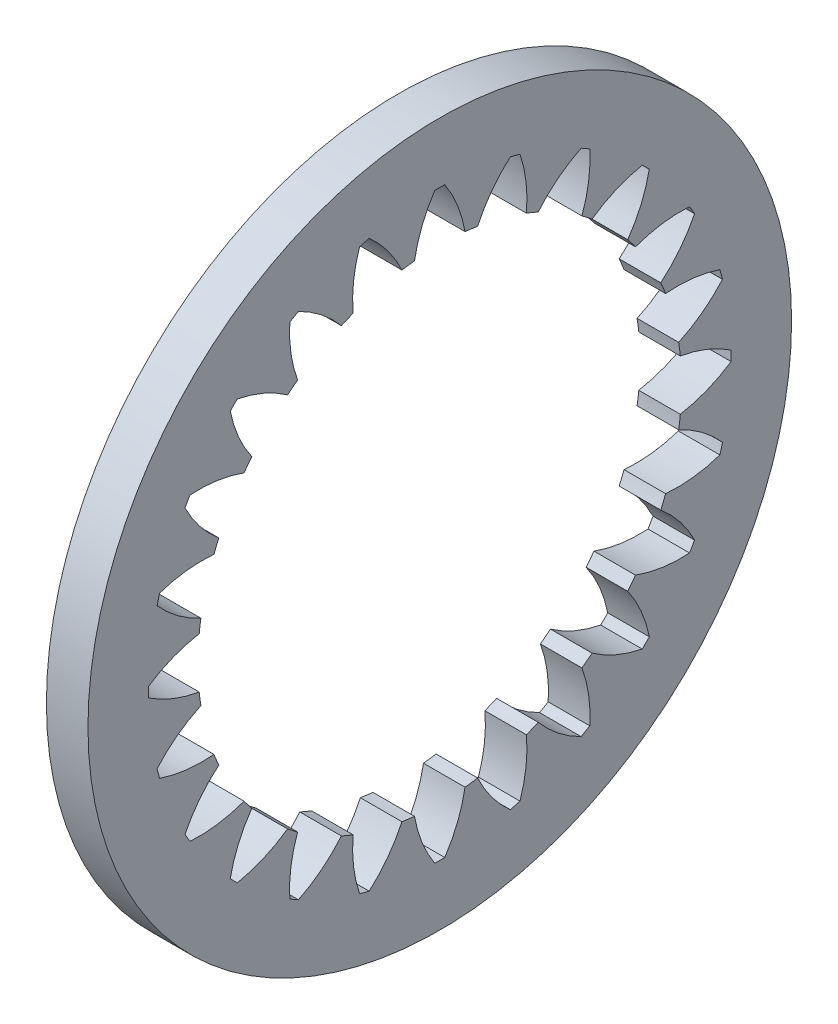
SolidWorks part; units mm, degrees
ref_plane "Plane1" through (0, 0, 0) normal (0, 0, 1) x (1, 0, 0)
ref_plane "Plane2" through (0, 0, 0) normal (0, 1, 0) x (1, 0, 0)
ref_plane "Plane3" through (0, 0, 0) normal (1, 0, 0) x (0, 0, -1)
other "Configuration Table"
sketch "HoldingSke" plane through (0, 0, 0) normal (0, 1, 0) x (1, 0, 0)
  line L0 (0, 0) -> (-0.0273, -0.1551)
  line L1 (-15, 0) -> (100, 0) construction
  line L2 (0, 0) -> (-2.1039, 2.3779)
  line L3 (0, 0) -> (-11.863, 4.5341)
  line L4 (0, 0) -> (7.8894, 3.5126)
  line L5 (0, 0) -> (-23.7986, -8.8762)
  line L6 (0, 0) -> (-10.5278, -7.1032)
  line L7 (-2.1039, 2.3779) -> (3.3635, 27.1825)
  line L8 (-76.2, 8.7279) -> (-54.61, 8.7279)
  line L9 (-67.7845, 28.3722) -> (-49.3413, 33.142)
  line L10 (-76.2, 71.12) -> (104.1128, 71.12)
  line L11 (0, 0) -> (-12, 0)
  line L12 (-76.2, 101.6) -> (-75.9714, 101.6)
  line L13 (24.9733, 27.94) -> (52.9518, 28.4284)
  line L14 (24.9733, 27.94) -> (24.9746, 27.94)
  line L15 (24.9733, 27.94) -> (100.4006, 29.5858)
  circle A0 centre (0, 0) radius 101.6
  circle A1 centre (0, 0) radius 12.7
  circle A2 centre (0, 0) radius 12.7
sketch "BasProSke" plane through (0, 0, 0) normal (0, 1, 0) x (1, 0, 0)
  line L0 (-10, 0) -> (60, 0) construction
  line L1 (0, 69.85) -> (0, 101.6)
  line L2 (0, 69.85) -> (12, 69.85)
  line L3 (12, 69.85) -> (12, 101.6)
  line L4 (12, 101.6) -> (0, 101.6)
revolve "Base-Revolve" add sketch "BasProSke" angle 360 about L0
sketch "TooCutSke" plane through (0, 0, 0) normal (1, 0, 0) x (0, 0, -1)
  line L3 (5.5552, 75.9972) -> (5.5552, 53.6633) construction
  line L4 (0, 0) -> (0, 59.563) construction
  line L5 (0, 0) -> (-8.9185, 67.7429) construction
  line L6 (-30.2541, 62.9855) -> (28.8527, 70.767) construction
  circle A0 centre (0, 0) radius 76.2 construction
  circle A1 centre (0, 0) radius 84.1388 construction
  circle A2 centre (0, 0) radius 66.3956 construction
  circle A3 centre (0, 0) radius 69.8246 construction
  arc A4 (7.2948, 69.4425) -> (1.4425, 84.1264) centre (-30.2541, 62.9855) ccw
  arc A5 (7.2948, 69.4425) -> (-7.2948, 69.4425) centre (0, 0) ccw
  arc A6 (1.4425, 84.1264) -> (-1.4425, 84.1264) centre (0, 0) ccw
  arc A7 (-1.4425, 84.1264) -> (-7.2948, 69.4425) centre (30.2541, 62.9855) ccw
extrude "ToothCut" cut sketch "TooCutSke" along normal through all
fillet "Breaks" [suppressed] radius 0.635
fillet "RootFillets" [suppressed] radius 1.5888
pattern_circular "TeethCuts" count 24 every 15 about axis through (-10, 0, 0) along (1, 0, 0) of "RootFillets", "Breaks", "ToothCut"
equation "' \"Module@HoldingSke\" = 6.35"
equation "' \"Num_teeth@HoldingSke\" = 24"
equation "' \"Ap@HoldingSke\" =  14.5"
equation "' \"Ap@HoldingSke\" = 14.5"
equation "' \"Width@HoldingSke\" = 12"
equation "' \"Diameter@HoldingSke\" = 8 * 25.4"
equation "' \"Show_teeth@HoldingSke\" = 100"
equation "' \"Backlash@HoldingSke\" = 0.009 * 25.4"
equation "' \"Addendum_fac@HoldingSke\" = 1.0"
equation "' \"Dedendum_fac@HoldingSke\" = 1.25"
equation "' \"Dedendum_add@HoldingSke\" = 0.00005 * 25.4"
equation "' \"Clearance_fac@HoldingSke\" = 0.25"
equation "\"Pitch@HoldingSke\" = 1 / \"Module@HoldingSke\" "
equation "\"Overcut_dia@TooCutSke\" = (\"Num_teeth@HoldingSke\" - 2 * \"Addendum_fac@HoldingSke\") / \"Pitch@HoldingSke\" - 0.002 * 25.4"
equation "\"Pitch_dia@TooCutSke\" = \"Num_teeth@HoldingSke\" / \"Pitch@HoldingSke\""
equation "\"Base_dia@TooCutSke\" = \"Num_teeth@HoldingSke\" / \"Pitch@HoldingSke\" * cos((\"Ap@HoldingSke\"  * 3.14159265 / 180)) * 0.90"
equation "\"Root_dia@TooCutSke\" = \"Num_teeth@HoldingSke\"  / \"Pitch@HoldingSke\" + 2 *  \"Dedendum_fac@HoldingSke\"/ \"Pitch@HoldingSke\" + \"Dedendum_add@HoldingSke\" * 2"
equation "\"Half_ang@TooCutSke\" = 180 / \"Num_teeth@HoldingSke\""
equation "\"Half_CT@TooCutSke\" = \"Num_teeth@HoldingSke\" / \"Pitch@HoldingSke\" * sin((3.14159265 / 2 / \"Num_teeth@HoldingSke\")) / 2 + 10 * \"Backlash@HoldingSke\" / 4"
equation "\"Flank_rad@TooCutSke\" = \"Num_teeth@HoldingSke\" / \"Pitch@HoldingSke\" / 4"
equation "\"Radius@RootFillets\"= \"Clearance_fac@HoldingSke\" / \"Pitch@HoldingSke\" + \"Dedendum_add@HoldingSke\""
equation "\"Break_rad@Breaks\" = 0.02 / \"Pitch@HoldingSke\" * 5"
equation "\"Num_teeth@TeethCuts\" = int( \"Show_teeth@HoldingSke\" ) + 1"
equation "\"Num_teeth@TeethCuts\" = ((sgn( \"Num_teeth@TeethCuts\" - \"Num_teeth@HoldingSke\" )-1)*( \"Num_teeth@TeethCuts\" - \"Num_teeth@HoldingSke\" ))/-2+ \"Num_teeth@HoldingSke\""
equation "\"Num_teeth@TeethCuts\" = ((sgn( \"Num_teeth@TeethCuts\" - 2.0)+1)*( \"Num_teeth@TeethCuts\" - 2.0))/2 +2.0"
equation "\"Angle@TeethCuts\" = 360.0 / \"Num_teeth@HoldingSke\""
equation "\"Diameter@BasProSke\" = \"Num_teeth@HoldingSke\"  / \"Pitch@HoldingSke\" + 2 *  \"Dedendum_fac@HoldingSke\"/ \"Pitch@HoldingSke\" + \"Dedendum_add@HoldingSke\" * 2 + 0.002 * 25.4"
equation "\"Diameter@BasProSke\" = ((sgn( \"Diameter@BasProSke\"  - \"Diameter@HoldingSke\" )+1)*( \"Diameter@BasProSke\"  - \"Diameter@HoldingSke\" ))/2 + \"Diameter@HoldingSke\""
equation "\"Inside_diameter@BasProSke\" =  (\"Num_teeth@HoldingSke\" - 2 * \"Addendum_fac@HoldingSke\") / \"Pitch@HoldingSke\" "
equation "\"Thickness@BasProSke\"  = \"Width@HoldingSke\""
